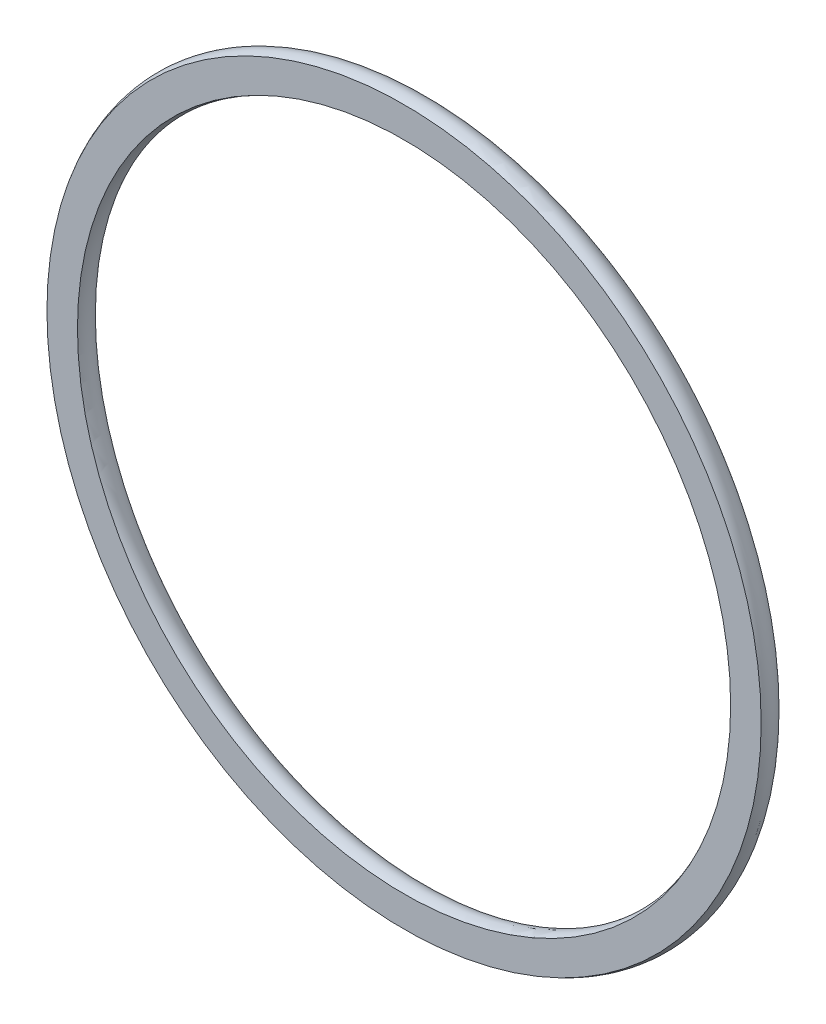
SolidWorks part; units mm, degrees
ref_plane "Front" through (0, 0, 0) normal (0, 0, 1) x (1, 0, 0)
ref_plane "Top" through (0, 0, 0) normal (0, 1, 0) x (1, 0, 0)
ref_plane "Right" through (0, 0, 0) normal (1, 0, 0) x (0, 0, -1)
sketch "Sketch1" plane through (0, 0, 0) normal (1, 0, 0) x (0, -1, 0)
  line L0 (0, -0.889) -> (0, 0.889) construction
  line L2 (-20.1308, 0) -> (20.1308, 0) construction
  line L3 (-16.5227, 0) -> (16.5227, 0) construction
  circle A0 centre (17.4117, 0) radius 0.889
  point P9 (16.5227, 0)
  point P10 (18.3007, 0)
  point P13 (17.4117, 0.889)
  point P14 (17.4117, -0.889)
  dimension "Width" = 1.778
  dimension "ID" = 33.0454
revolve "Revolve1" add sketch "Sketch1" angle 360 about L0
ref_plane "Plane1" through (0, 0, 0.889) normal (0, 0, 1) x (1, 0, 0)
sketch "Sketch2" plane through (0, 0, 0.889) normal (0, 0, 1) x (1, 0, 0)
  line L1 (-21.6045, -20.9408) -> (27.9211, -20.9408)
  line L2 (-21.6045, -20.9408) -> (-21.6045, 22.1943)
  line L3 (-21.6045, 22.1943) -> (27.9211, 22.1943)
  line L4 (27.9211, -20.9408) -> (27.9211, 22.1943)
extrude "Cut-Extrude1" cut sketch "Sketch2" against normal blind 0.4572
